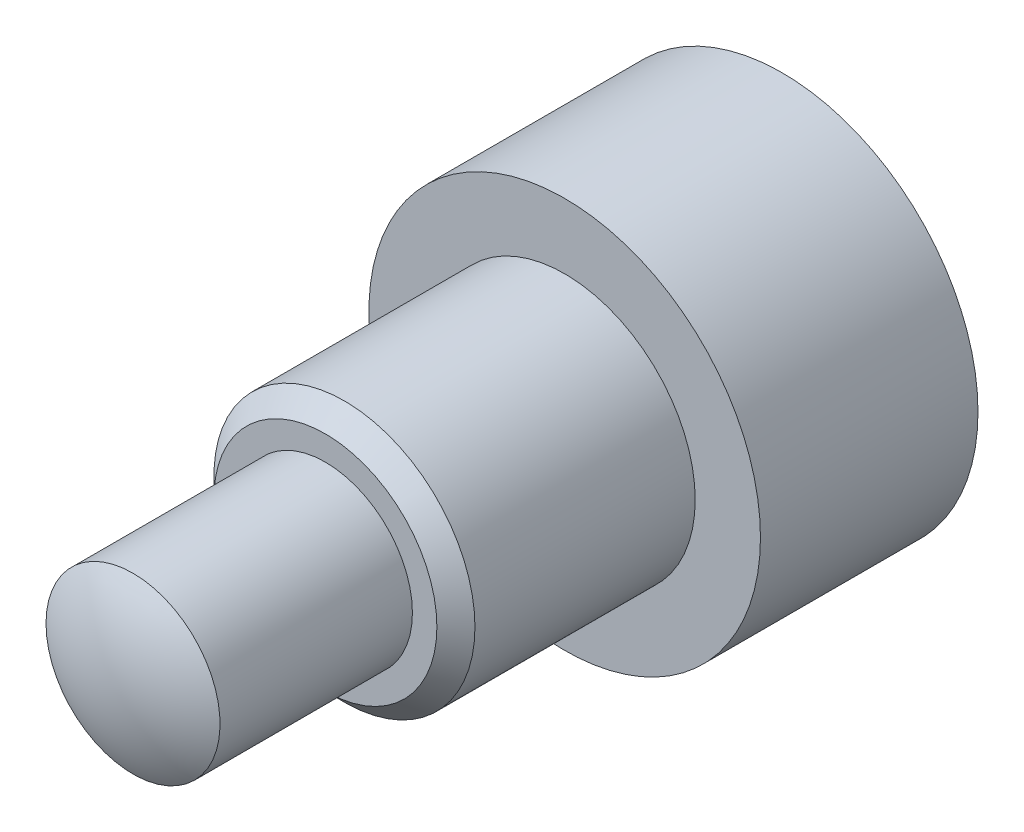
SolidWorks part; units mm, degrees
ref_plane "Plan de face" through (0, 0, 0) normal (0, 0, 1) x (1, 0, 0)
ref_plane "Plan de dessus" through (0, 0, 0) normal (0, 1, 0) x (1, 0, 0)
ref_plane "Plan de droite" through (0, 0, 0) normal (1, 0, 0) x (0, 0, -1)
sketch "Esquisse1" plane through (0, 0, 0) normal (0, 0, 1) x (1, 0, 0)
  circle A0 centre (0, 0) radius 9
  dimension "D1" = 18
extrude "Extrusion1" add sketch "Esquisse1" along normal blind 10
sketch "Esquisse2" plane through (0, 0, 10) normal (0, 0, 1) x (1, 0, 0)
  circle A0 centre (0, 0) radius 6
  dimension "D1" = 12
extrude "Extrusion2" add sketch "Esquisse2" along normal blind 11
sketch "Esquisse3" plane through (0, 0, 21) normal (0, 0, 1) x (1, 0, 0)
  circle A0 centre (0, 0) radius 4
  dimension "D1" = 8
extrude "Extrusion3" add sketch "Esquisse3" along normal blind 10
sketch "Esquisse4" plane through (0, 0, 0) normal (1, 0, 0) x (0, 0, -1)
  line L0 (-31, 4) -> (-31, -4) construction
  line L1 (-26.5884, 0) -> (-32.9037, 0) construction
  line L2 (-29.8241, 4.0319) -> (-36.8515, 7.02)
  line L3 (-36.8515, 7.02) -> (-38.7401, 0)
  line L4 (-38.7401, 0) -> (-31, 0)
  arc A0 (-29.8241, 4.0319) -> (-31, 0) centre (-23.5, 0) ccw
  dimension "D1" = 15
revolve "Enlèvement de matière-Révolution6" cut sketch "Esquisse4" angle 360 about L1
chamfer "Chanfrein1" distance 0.875 angle 45 1 edges at (6, 0, 21)
